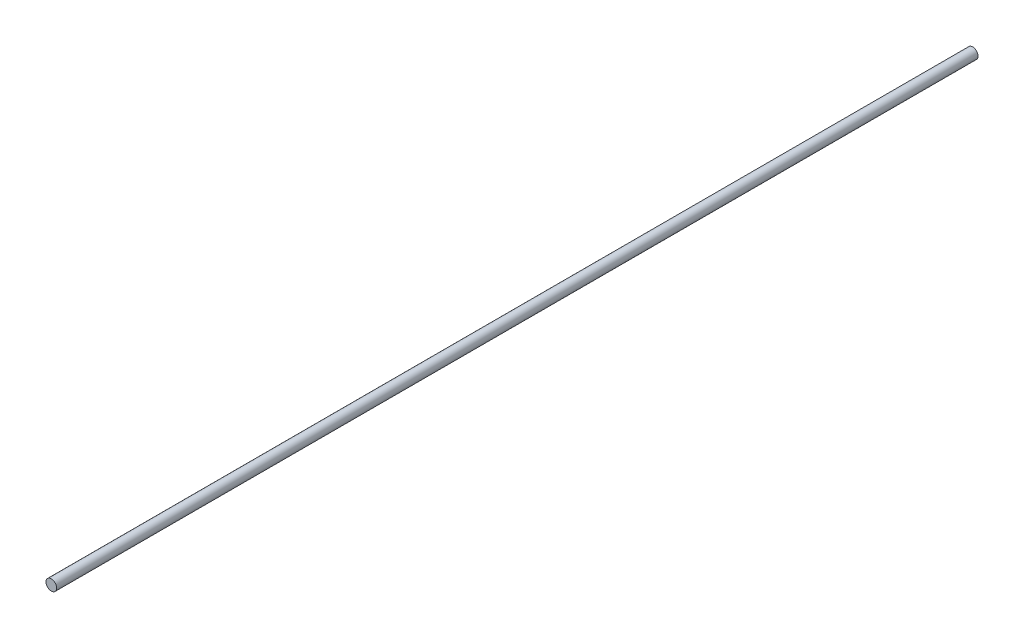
SolidWorks part; units mm, degrees
ref_plane "Front Plane" through (0, 0, 0) normal (0, 0, 1) x (1, 0, 0)
ref_plane "Top Plane" through (0, 0, 0) normal (0, 1, 0) x (1, 0, 0)
ref_plane "Right Plane" through (0, 0, 0) normal (1, 0, 0) x (0, 0, -1)
sketch "Sketch1" plane through (0, 0, 0) normal (0, 0, 1) x (1, 0, 0)
  circle A0 centre (0, 0) radius 30
  dimension "D1" = 60
extrude "Boss-Extrude1" add sketch "Sketch1" against normal blind 5200
